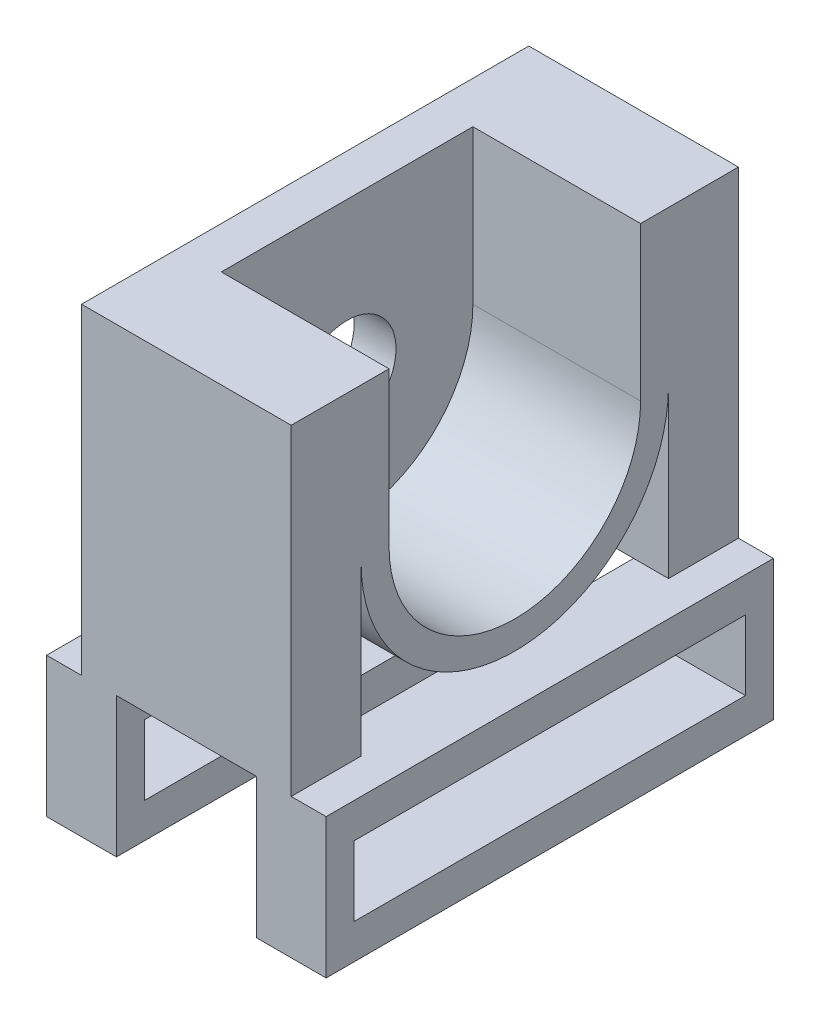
SolidWorks part; units mm, degrees
ref_plane "Front Plane" through (0, 0, 0) normal (0, 0, 1) x (1, 0, 0)
ref_plane "Top Plane" through (0, 0, 0) normal (0, 1, 0) x (1, 0, 0)
ref_plane "Right Plane" through (0, 0, 0) normal (1, 0, 0) x (0, 0, -1)
sketch "Sketch1" plane through (0, 0, 0) normal (1, 0, 0) x (0, 0, -1)
  line L2 (-11, 0) -> (-11, 11)
  line L3 (-11, 11) -> (11, 11)
  line L4 (11, 0) -> (11, 11)
  arc A0 (-11, 0) -> (11, 0) centre (0, 0) ccw
  dimension "D1" = 22
  dimension "D2" = 11
extrude "Boss-Extrude2" add sketch "Sketch1" along normal blind 15
sketch "Sketch2" plane through (15, 0, 0) normal (1, 0, 0) x (0, 0, -1)
  line L0 (11, 11) -> (-11, 11) construction
  line L2 (-9, 0) -> (-9, 11)
  line L3 (-9, 11) -> (9, 11)
  line L4 (9, 0) -> (9, 11)
  arc A0 (-9, 0) -> (9, 0) centre (0, 0) ccw
  dimension "D1" = 18
extrude "Cut-Extrude1" cut sketch "Sketch2" against normal blind 12 contours A0 L4 L3 L2
sketch "Sketch3" plane through (3, 0, 0) normal (1, 0, 0) x (0, 0, -1)
  circle A0 centre (0, 0) radius 3.5
  dimension "D1" = 7
extrude "Cut-Extrude2" cut sketch "Sketch3" against normal through all contours A0
sketch "Sketch4" plane through (0, 0, -11) normal (0, 0, -1) x (-1, 0, 0)
  line L1 (-15, 11) -> (0, 11)
  line L2 (-15, 11) -> (-15, 0)
  line L3 (-15, 0) -> (0, 0)
  line L4 (0, 11) -> (0, 0)
extrude "Boss-Extrude3" add sketch "Sketch4" along normal blind 5 contours L2 L1 L4 L3
sketch "Sketch5" plane through (0, 0, 0) normal (0, -1, 0) x (1, 0, 0)
  line L1 (0, -11) -> (15, -11)
  line L2 (0, -11) -> (0, -16)
  line L3 (0, -16) -> (15, -16)
  line L4 (15, -11) -> (15, -16)
extrude "Boss-Extrude5" add sketch "Sketch5" along normal blind 16 contours L2 L1 L4 L3
sketch "Sketch6" plane through (0, 0, 11) normal (0, 0, 1) x (1, 0, 0)
  line L1 (0, 11) -> (15, 11)
  line L2 (0, 11) -> (0, 0)
  line L3 (0, 0) -> (15, 0)
  line L4 (15, 11) -> (15, 0)
extrude "Boss-Extrude6" add sketch "Sketch6" along normal blind 5 contours L2 L1 L4 L3
sketch "Sketch7" plane through (0, 0, 0) normal (0, -1, 0) x (1, 0, 0)
  line L1 (0, 16) -> (15, 16)
  line L2 (0, 16) -> (0, 11)
  line L3 (0, 11) -> (15, 11)
  line L4 (15, 16) -> (15, 11)
extrude "Boss-Extrude7" add sketch "Sketch7" along normal blind 16 contours L2 L1 L4 L3
sketch "Sketch8" plane through (0, 0, 11) normal (0, 0, -1) x (-1, 0, 0)
  line L0 (0, -16) -> (0, 0) construction
  line L1 (-15, -16) -> (0, -16)
  line L2 (-15, -16) -> (-15, -12.6972)
  line L3 (-15, -12.6972) -> (0, -12.6972)
  line L4 (0, -16) -> (0, -12.6972)
  dimension "D1" = 3.3028
sketch "Sketch9" plane through (0, -16, 0) normal (0, -1, 0) x (1, 0, 0)
  line L1 (0, 16) -> (15, 16)
  line L2 (0, 16) -> (0, 11)
  line L3 (0, 11) -> (15, 11)
  line L4 (15, 16) -> (15, 11)
  line L5 (0, -11) -> (15, -11)
  line L6 (0, -11) -> (0, -16)
  line L7 (0, -16) -> (15, -16)
  line L8 (15, -11) -> (15, -16)
extrude "Boss-Extrude8" add sketch "Sketch9" along normal blind 6
sketch "Sketch10" plane through (15, 0, 0) normal (1, 0, 0) x (0, 0, -1)
  line L0 (16, 11) -> (16, -22) construction
  line L1 (11, -22) -> (16, -22)
  line L2 (11, -22) -> (11, -11)
  line L3 (11, -11) -> (16, -11)
  line L4 (16, -22) -> (16, -11)
  line L5 (-11, -22) -> (-11, 0) construction
  line L6 (-16, -22) -> (-11, -22)
  line L7 (-16, -22) -> (-16, -11)
  line L8 (-16, -11) -> (-11, -11)
  line L9 (-11, -22) -> (-11, -11)
  dimension "D1" = 11
  dimension "D2" = 11
sketch "Sketch11" plane through (0, 0, 0) normal (-1, 0, 0) x (0, 0, 1)
  line L0 (-11, -22) -> (-11, 0) construction
  line L1 (-16, -22) -> (-11, -22)
  line L2 (-16, -22) -> (-16, -11)
  line L3 (-16, -11) -> (-11, -11)
  line L4 (-11, -22) -> (-11, -11)
  line L5 (16, 11) -> (16, -22) construction
  line L6 (11, -22) -> (16, -22)
  line L7 (11, -22) -> (11, -11)
  line L8 (11, -11) -> (16, -11)
  line L9 (16, -22) -> (16, -11)
  dimension "D1" = 11
  dimension "D2" = 11
sketch "Sketch13" plane through (0, 0, 11) normal (0, 0, -1) x (-1, 0, 0)
  line L0 (-15, -16) -> (-15, -12.6972) construction
  line L1 (0, -22) -> (-15, -22)
  line L2 (0, -22) -> (0, -12)
  line L3 (0, -12) -> (-15, -12)
  line L4 (-15, -22) -> (-15, -12)
  dimension "D1" = 10
extrude "Boss-Extrude15" add sketch "Sketch13" along normal up to next contours L2 L1 L4 L3
sketch "Sketch14" plane through (15, 0, 0) normal (1, 0, 0) x (0, 0, -1)
  line L0 (16, -22) -> (16, -11) construction
  line L1 (-16, -22) -> (16, -22)
  line L2 (-16, -22) -> (-16, -12)
  line L3 (-16, -12) -> (16, -12)
  line L4 (16, -22) -> (16, -12)
  line L6 (11, -12) -> (-11, -12) construction
extrude "Boss-Extrude16" add sketch "Sketch14" along normal blind 2.5 contours L2 L1 L4 L3
sketch "Sketch15" plane through (0, 0, 0) normal (-1, 0, 0) x (0, 0, 1)
  line L0 (16, -22) -> (16, -11) construction
  line L1 (-16, -22) -> (16, -22)
  line L2 (-16, -22) -> (-16, -12)
  line L3 (-16, -12) -> (16, -12)
  line L4 (16, -22) -> (16, -12)
  line L5 (-11, -12) -> (11, -12) construction
extrude "Boss-Extrude17" add sketch "Sketch15" along normal blind 2.5 contours L2 L1 L4 L3
sketch "Sketch16" plane through (-2.5, 0, 0) normal (-1, 0, 0) x (0, 0, 1)
  line L0 (-16, -22) -> (-16, -11) construction
  line L1 (-14, -19.5) -> (14, -19.5)
  line L2 (-14, -19.5) -> (-14, -14.5)
  line L3 (-14, -14.5) -> (14, -14.5)
  line L4 (14, -19.5) -> (14, -14.5)
  line L5 (16, -22) -> (16, -11) construction
  line L6 (-16, -22) -> (16, -22) construction
  line L7 (-16, -12) -> (16, -12) construction
  dimension "D1" = 2
  dimension "D2" = 2
  dimension "D3" = 2.5
  dimension "D4" = 2.5
extrude "Cut-Extrude4" cut sketch "Sketch16" against normal through all contours L1 L4 L3 L2
sketch "Sketch17" plane through (0, 0, 16) normal (0, 0, 1) x (1, 0, 0)
  line L0 (17.5, -22) -> (-2.5, -22) construction
  line L1 (2.5, -22) -> (12.5, -22)
  line L2 (2.5, -22) -> (2.5, -12)
  line L3 (2.5, -12) -> (12.5, -12)
  line L4 (12.5, -22) -> (12.5, -12)
  line L5 (-2.5, -12) -> (0, -12) construction
  line L6 (-2.5, -22) -> (-2.5, -12) construction
  line L7 (17.5, -22) -> (17.5, -12) construction
  dimension "D1" = 5
  dimension "D2" = 5
extrude "Cut-Extrude5" cut sketch "Sketch17" against normal through all contours L2 L1 L4 L3
